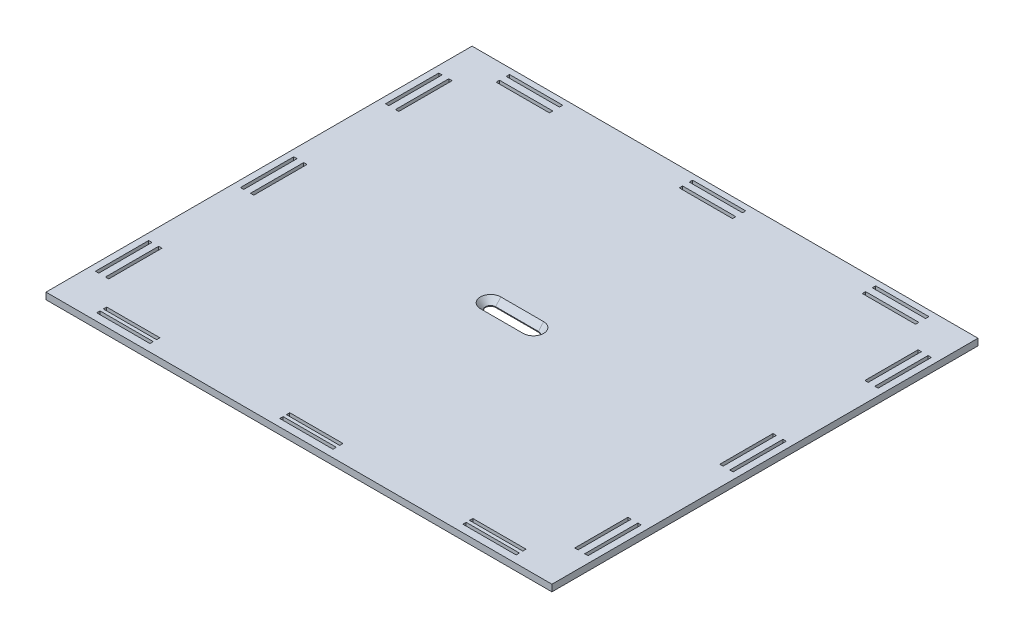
SolidWorks part; units mm, degrees
ref_plane "Front Plane" through (0, 0, 0) normal (0, 0, 1) x (1, 0, 0)
ref_plane "Top Plane" through (0, 0, 0) normal (0, 1, 0) x (1, 0, 0)
ref_plane "Right Plane" through (0, 0, 0) normal (1, 0, 0) x (0, 0, -1)
sketch "Sketch1" plane through (0, 0, 0) normal (0, 1, 0) x (1, 0, 0)
  line L1 (-208.8969, 227.4933) -> (273.7031, 227.4933)
  line L2 (-208.8969, 227.4933) -> (-208.8969, -178.9067)
  line L3 (-208.8969, -178.9067) -> (273.7031, -178.9067)
  line L4 (273.7031, 227.4933) -> (273.7031, -178.9067)
  line L5 (-208.8969, 227.4933) -> (273.7031, -178.9067) construction
  line L6 (-208.8969, -178.9067) -> (273.7031, 227.4933) construction
  line L11 (-205.7219, 224.8196) -> (270.5281, -176.233) construction
  line L12 (-205.7219, -176.233) -> (270.5281, 224.8196) construction
  point P4 (32.4031, 24.2933)
  point P9 (32.4031, 24.2933)
  dimension "D1" = 482.6
  dimension "D2" = 406.4
extrude "Boss-Extrude1" add sketch "Sketch1" along normal blind 6.35
sketch "Sketch2" plane through (0, 6.35, 0) normal (0, 1, 0) x (1, 0, 0)
  line L1 (-208.8969, 227.4933) -> (273.7031, 227.4933)
  line L2 (-208.8969, 227.4933) -> (-208.8969, -178.9067)
  line L3 (-208.8969, -178.9067) -> (273.7031, -178.9067)
  line L4 (273.7031, 227.4933) -> (273.7031, -178.9067)
  line L5 (-208.8969, 227.4933) -> (273.7031, -178.9067) construction
  line L6 (-208.8969, -178.9067) -> (273.7031, 227.4933) construction
  line L7 (-205.7219, 224.8196) -> (270.5281, 224.8196)
  line L8 (-205.7219, 224.8196) -> (-205.7219, -176.233)
  line L9 (-205.7219, -176.233) -> (270.5281, -176.233)
  line L10 (270.5281, 224.8196) -> (270.5281, -176.233)
  line L11 (-205.7219, 224.8196) -> (270.5281, -176.233) construction
  line L12 (-205.7219, -176.233) -> (270.5281, 224.8196) construction
  point P4 (32.4031, 24.2933)
  point P11 (32.4031, 24.2933)
  dimension "D1" = 3.175
  dimension "D2" = 3.175
extrude "Boss-Extrude2" add sketch "Sketch2" along normal blind 3.175
sketch "Sketch3" plane through (0, 6.35, 0) normal (0, 1, 0) x (1, 0, 0)
  line L1 (-187.3069, 206.2843) -> (252.1131, 206.2843)
  line L2 (-187.3069, 206.2843) -> (-187.3069, -157.6977)
  line L3 (-187.3069, -157.6977) -> (252.1131, -157.6977)
  line L4 (252.1131, 206.2843) -> (252.1131, -157.6977)
  line L5 (-187.3069, 206.2843) -> (252.1131, -157.6977) construction
  line L6 (-187.3069, -157.6977) -> (252.1131, 206.2843) construction
  point P4 (32.4031, 24.2933)
  dimension "D1" = 439.42
  dimension "D2" = 363.982
sketch "Sketch5" plane through (0, 6.35, 0) normal (0, 1, 0) x (1, 0, 0)
  line L0 (-205.7219, 214.8304) -> (270.5281, 214.8304) construction
  line L1 (-205.7219, 224.8196) -> (-205.7219, -176.233) construction
  line L2 (270.5281, -176.233) -> (270.5281, 224.8196) construction
  line L3 (-187.3069, 24.2933) -> (252.1131, 24.2933) construction
  line L4 (-187.3069, 206.2843) -> (-187.3069, -157.6977) construction
  line L5 (252.1131, 206.2843) -> (252.1131, -157.6977) construction
  line L6 (207.0281, 224.8196) -> (207.0281, 206.2843) construction
  line L7 (270.5281, 224.8196) -> (-205.7219, 224.8196) construction
  line L8 (-187.3069, 206.2843) -> (252.1131, 206.2843) construction
  line L9 (-142.2219, 224.8196) -> (-142.2219, 206.2843) construction
  line L11 (-196.8626, 224.8196) -> (-196.8626, -176.233) construction
  line L12 (-205.7219, -176.233) -> (270.5281, -176.233) construction
  line L13 (-187.3069, 161.3196) -> (-205.7219, 161.3196) construction
  line L14 (-187.3069, -112.733) -> (-205.7219, -112.733) construction
  dimension "D1" = 63.5
  dimension "D2" = 63.5
  dimension "D3" = 63.5
  dimension "D4" = 63.5
sketch "Sketch4" plane through (0, 6.35, 0) normal (0, 1, 0) x (1, 0, 0)
  line L0 (-208.8969, 227.4933) -> (-208.8969, -178.9067) construction
  line L1 (-167.6219, 221.9292) -> (-116.8219, 221.9292)
  line L2 (-167.6219, 221.9292) -> (-167.6219, 218.7542)
  line L3 (-167.6219, 218.7542) -> (-116.8219, 218.7542)
  line L4 (-116.8219, 221.9292) -> (-116.8219, 218.7542)
  line L5 (-167.6219, 221.9292) -> (-116.8219, 218.7542) construction
  line L6 (-167.6219, 218.7542) -> (-116.8219, 221.9292) construction
  line L7 (-167.6219, 212.4042) -> (-116.8219, 212.4042)
  line L8 (-167.6219, 212.4042) -> (-167.6219, 209.2292)
  line L9 (-167.6219, 209.2292) -> (-116.8219, 209.2292)
  line L10 (-116.8219, 212.4042) -> (-116.8219, 209.2292)
  line L11 (-167.6219, 212.4042) -> (-116.8219, 209.2292) construction
  line L12 (-167.6219, 209.2292) -> (-116.8219, 212.4042) construction
  line L15 (-167.6219, -162.3055) -> (-116.8219, -162.3055)
  line L16 (-167.6219, -162.3055) -> (-167.6219, -165.4805)
  line L17 (-167.6219, -165.4805) -> (-116.8219, -165.4805)
  line L18 (-116.8219, -162.3055) -> (-116.8219, -165.4805)
  line L19 (-167.6219, -168.6555) -> (-116.8219, -168.6555)
  line L20 (-167.6219, -168.6555) -> (-167.6219, -171.8305)
  line L21 (-167.6219, -171.8305) -> (-116.8219, -171.8305)
  line L22 (-116.8219, -168.6555) -> (-116.8219, -171.8305)
  point P4 (-142.2219, 220.3417)
  point P9 (-142.2219, 210.8167)
  dimension "D1" = 6.35
  dimension "D2" = 50.8
  dimension "D3" = 3.175
  dimension "D4" = 3.175
  dimension "D5" = 41.275
extrude "Cut-Extrude2" cut sketch "Sketch4" against normal through all both and the other way through all
pattern_linear "LPattern1" count 3 spacing 174.625 along (1, 0, 0) of "Cut-Extrude2"
sketch "Sketch7" plane through (0, 6.35, 0) normal (0, 1, 0) x (1, 0, 0)
  line L13 (273.7031, 227.4933) -> (-208.8969, 227.4933) construction
  line L14 (-202.5469, 189.3933) -> (-199.3719, 189.3933)
  line L19 (-202.5469, 189.3933) -> (-202.5469, 138.5933)
  line L20 (-202.5469, 138.5933) -> (-199.3719, 138.5933)
  line L26 (-193.0219, 189.3933) -> (-189.8469, 189.3933)
  line L27 (-193.0219, 189.3933) -> (-193.0219, 138.5933)
  line L32 (-193.0219, 138.5933) -> (-189.8469, 138.5933)
  line L33 (-189.8469, 189.3933) -> (-189.8469, 138.5933)
  line L37 (-199.3719, 189.3933) -> (-199.3719, 138.5933)
  line L38 (-202.5469, 189.3933) -> (-199.3719, 138.5933) construction
  line L39 (-202.5469, 138.5933) -> (-199.3719, 189.3933) construction
  line L40 (-208.8969, 227.4933) -> (-208.8969, -178.9067) construction
  line L41 (32.4031, 224.8196) -> (32.4031, 11.7754) construction
  line L42 (270.5281, 224.8196) -> (-205.7219, 224.8196) construction
  line L43 (257.8281, 189.3933) -> (257.8281, 138.5933)
  line L44 (257.8281, 138.5933) -> (254.6531, 138.5933)
  line L45 (254.6531, 189.3933) -> (254.6531, 138.5933)
  line L46 (257.8281, 189.3933) -> (254.6531, 189.3933)
  line L47 (267.3531, 138.5933) -> (264.1781, 138.5933)
  line L48 (264.1781, 189.3933) -> (264.1781, 138.5933)
  line L49 (267.3531, 189.3933) -> (264.1781, 189.3933)
  line L50 (267.3531, 189.3933) -> (267.3531, 138.5933)
  point P0 (-200.9594, 163.9933)
  dimension "D1" = 3.175
  dimension "D2" = 6.35
  dimension "D3" = 6.35
  dimension "D4" = 50.8
  dimension "D5" = 38.1
extrude "Cut-Extrude3" cut sketch "Sketch7" against normal through all both and the other way through all
pattern_linear "LPattern2" count 3 spacing 138.3632 along (0, 0, 1) of "Cut-Extrude3"
sketch "Sketch9" plane through (0, 9.525, 0) normal (0, 1, 0) x (1, 0, 0)
  line L0 (-208.8969, 227.4933) -> (-208.8969, -178.9067) construction
  line L1 (-208.8969, -178.9067) -> (273.7031, -178.9067) construction
  line L2 (273.7031, -178.9067) -> (273.7031, 227.4933) construction
  line L3 (273.7031, 227.4933) -> (-208.8969, 227.4933) construction
  line L4 (-205.7219, -176.233) -> (270.5281, -176.233) construction
  line L5 (270.5281, -176.233) -> (270.5281, 224.8196) construction
  line L6 (270.5281, 224.8196) -> (-205.7219, 224.8196) construction
  line L7 (-205.7219, 224.8196) -> (-205.7219, -176.233) construction
  line L8 (-205.7219, -176.233) -> (270.5281, -176.233)
  line L9 (270.5281, -176.233) -> (270.5281, 224.8196)
  line L10 (270.5281, 224.8196) -> (-205.7219, 224.8196)
  line L11 (-205.7219, 224.8196) -> (-205.7219, -176.233)
  line L12 (-208.8969, -178.9067) -> (273.7031, -178.9067)
  line L13 (273.7031, -178.9067) -> (273.7031, 227.4933)
  line L14 (-208.8969, 227.4933) -> (-208.8969, -178.9067)
  line L15 (273.7031, 227.4933) -> (-208.8969, 227.4933)
extrude "Cut-Extrude5" cut sketch "Sketch9" against normal blind 3.175
sketch "Sketch19" plane through (0, 6.35, 0) normal (0, 1, 0) x (1, 0, 0)
  line L0 (11.9831, 29.1193) -> (52.8231, 29.1193)
  line L1 (11.9831, 19.4673) -> (52.8231, 19.4673)
  line L2 (32.4031, 227.4933) -> (32.4031, -178.9067) construction
  line L3 (273.7031, 227.4933) -> (-208.8969, 227.4933) construction
  line L4 (-208.8969, -178.9067) -> (273.7031, -178.9067) construction
  line L5 (-208.8969, 24.2933) -> (273.7031, 24.2933) construction
  line L6 (-208.8969, 227.4933) -> (-208.8969, -178.9067) construction
  line L7 (273.7031, -178.9067) -> (273.7031, 227.4933) construction
  circle A6 centre (11.9831, 24.2933) radius 9.6774 construction
  arc A7 (11.9831, 29.1193) -> (11.9831, 19.4673) centre (11.9831, 24.2933) ccw
  arc A8 (52.8231, 19.4673) -> (52.8231, 29.1193) centre (52.8231, 24.2933) ccw
  circle A9 centre (52.8231, 24.2933) radius 9.6774 construction
  point P14 (32.4031, 29.1193)
  dimension "D2" = 9.652
  dimension "D3" = 9.652
  dimension "D1" = 40.84
extrude "Cut-Extrude6" cut sketch "Sketch19" against normal through all
chamfer "Chamfer2" distance 4.9149 angle 49 4 edges at (57.6491, 6.35, -24.2933) (32.4031, 6.35, -19.4673) (7.1571, 6.35, -24.2933) (32.4031, 6.35, -29.1193)
